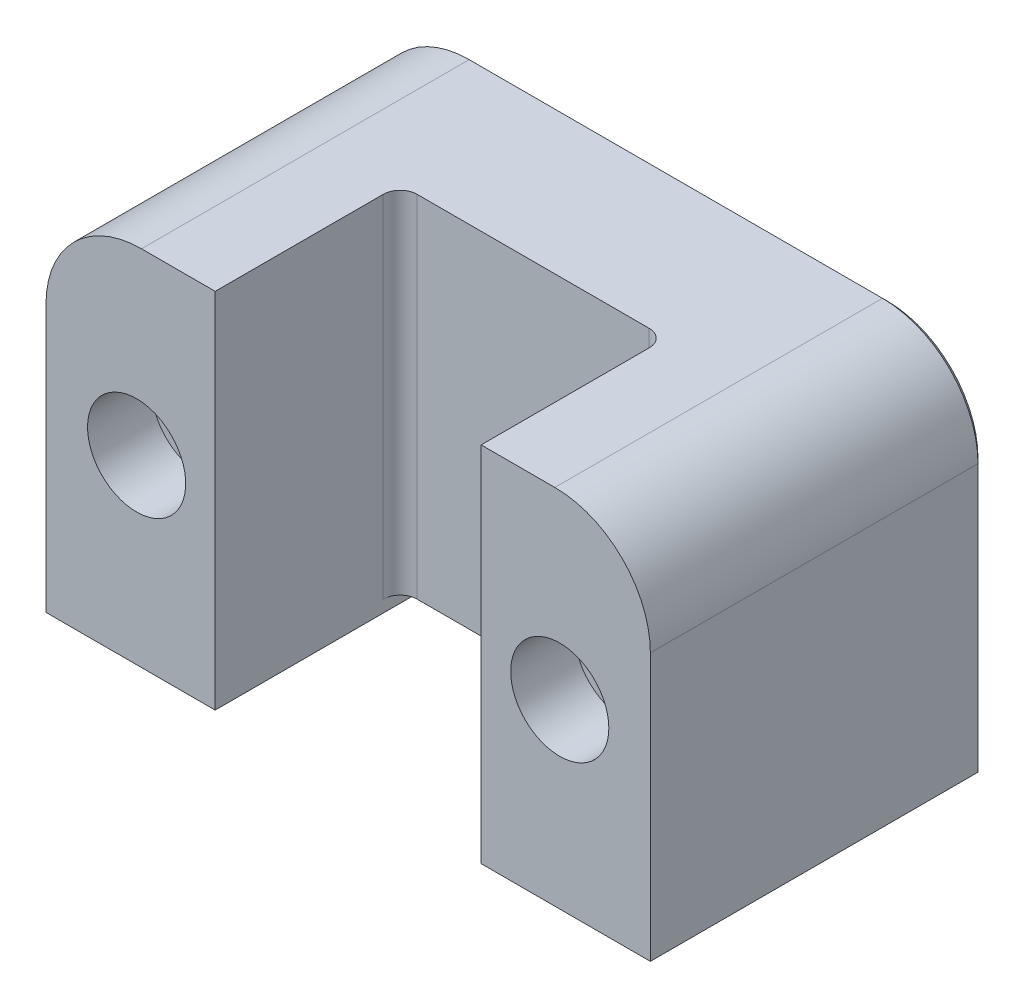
SolidWorks part; units mm, degrees
ref_plane "Front Plane" through (0, 0, 0) normal (0, 0, 1) x (1, 0, 0)
ref_plane "Top Plane" through (0, 0, 0) normal (0, 1, 0) x (1, 0, 0)
ref_plane "Right Plane" through (0, 0, 0) normal (1, 0, 0) x (0, 0, -1)
sketch "Sketch1" plane through (0, 0, 0) normal (0, 1, 0) x (1, 0, 0)
  line L0 (-55, 0) -> (55, 0) construction
  line L1 (-31.7436, 0) -> (-13.97, 0)
  line L2 (-31.7436, 0) -> (-31.7436, 34.925)
  line L3 (-31.7436, 34.925) -> (31.7436, 34.925)
  line L4 (31.7436, 0) -> (31.7436, 34.925)
  line L5 (0, -55) -> (0, 55) construction
  line L6 (13.97, 0) -> (31.7436, 0)
  line L8 (-13.97, 0) -> (-13.97, 19.431)
  line L9 (-13.97, 19.431) -> (13.97, 19.431)
  line L10 (13.97, 0) -> (13.97, 19.431)
  dimension "D1" = 63.4873
  dimension "D2" = 34.925
  dimension "D3" = 31.7436
  dimension "D4" = 27.94
  dimension "D5" = 19.431
  dimension "D6" = 13.97
extrude "Extrude1" add sketch "Sketch1" along normal blind 38.1
sketch "Sketch3" plane through (0, 0, 0) normal (0, -1, 0) x (1, 0, 0)
  line L0 (13.97, -19.431) -> (13.97, 0) construction
  line L1 (-13.97, -25.781) -> (13.97, -25.781)
  line L2 (-13.97, -25.781) -> (-13.97, -14.0109)
  line L3 (-13.97, -14.0109) -> (13.97, -14.0109)
  line L4 (13.97, -25.781) -> (13.97, -14.0109)
  line L5 (55, 0) -> (-55, 0) construction
  line L6 (-13.97, 0) -> (-13.97, -19.431) construction
  dimension "D1" = 25.781
  dimension "D2" = 11.7701
extrude "Cut-Extrude2" cut sketch "Sketch3" against normal blind 1.27
fillet "Fillet3" radius 2.032 2 edges at (13.97, 0.635, -25.781) (-13.97, 0.635, -25.781)
fillet "Fillet4" radius 1.778 2 edges at (13.97, 19.685, -19.431) (-13.97, 19.685, -19.431)
ref_plane "Plane1" through (0, 19.05, 0) normal (0, 1, 0) x (-1, 0, 0)
sketch "Sketch4" plane through (0, 19.05, 0) normal (0, 1, 0) x (-1, 0, 0)
  line L0 (22.225, -34.925) -> (22.225, 0)
  line L2 (22.225, 0) -> (17.0688, 0)
  line L4 (17.0688, 0) -> (17.0688, -6.7564)
  line L5 (17.0688, -6.7564) -> (18.6563, -6.7564)
  line L7 (18.6563, -6.7564) -> (18.6563, -34.925)
  line L8 (18.6563, -34.925) -> (22.225, -34.925)
  line L9 (22.225, -4.7498) -> (22.225, 6.5086) construction
  line L10 (22.225, 6.5086) -> (22.225, -40.8278) construction
  line L12 (55, 0) -> (-55, 0) construction
  line L13 (31.7436, 0) -> (13.97, 0) construction
  line L14 (-31.7436, -34.925) -> (31.7436, -34.925) construction
  line L15 (0, 55) -> (0, -55) construction
  dimension "D1" = 10.3124
  dimension "D2" = 7.1374
  dimension "D3" = 6.7564
  dimension "D4" = 22.225
revolve "Cut-Revolve9" cut sketch "Sketch4" angle 360 about L9
mirror "Mirror1" about plane through (0, 0, 0) normal (1, 0, 0) of "Cut-Revolve9"
fillet "Fillet5" radius 10.033 2 edges at (31.7436, 38.1, -17.4625) (-31.7436, 38.1, -17.4625)
chamfer "Chamfer1" distance 0.508 angle 45 5 edges at (31.7436, 14.0335, -34.925) (-31.7436, 14.0335, -34.925) (28.8051, 35.1614, -34.925) (-28.8051, 35.1614, -34.925) (0, 38.1, -34.925)
